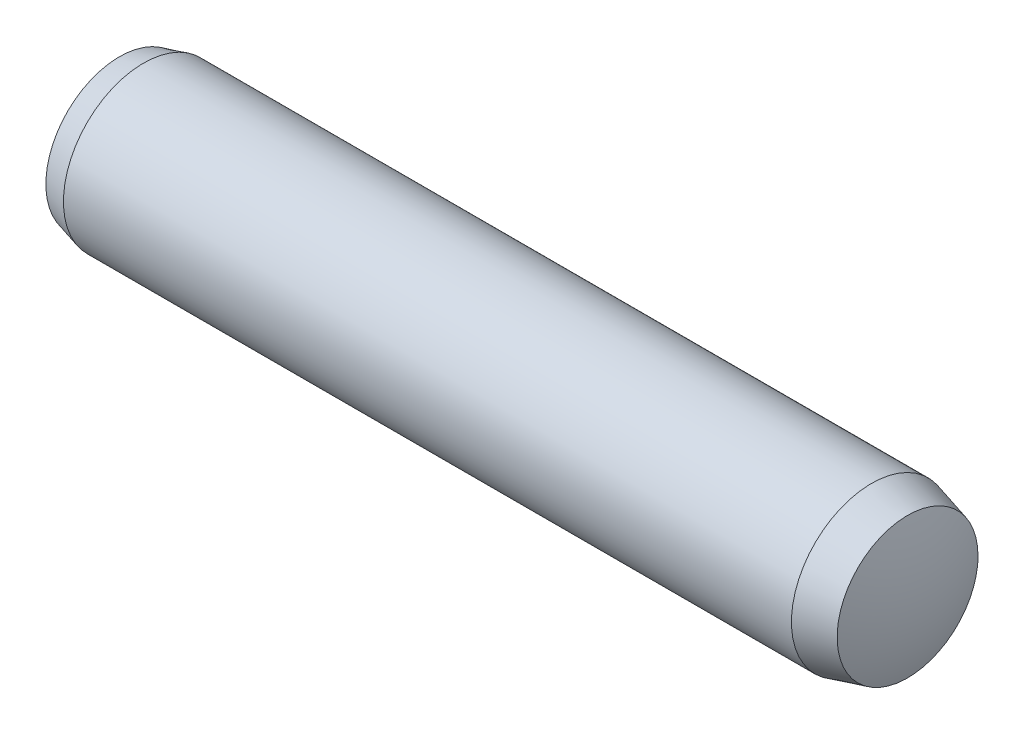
SolidWorks part; units mm, degrees
ref_plane "Plan de face" through (0, 0, 0) normal (0, 0, 1) x (1, 0, 0)
ref_plane "Plan de dessus" through (0, 0, 0) normal (0, 1, 0) x (1, 0, 0)
ref_plane "Plan de droite" through (0, 0, 0) normal (1, 0, 0) x (0, 0, -1)
sketch "Esquisse1" plane through (0, 0, 0) normal (0, 1, 0) x (1, 0, 0)
  line L0 (9.9605, 0) -> (8.8, 2.01)
  line L1 (8.8, 2.01) -> (0.8, 2.01)
  line L2 (0.8, 2.01) -> (0.8, 3.25)
  line L3 (0.8, 3.25) -> (0, 3.25)
  line L4 (0, 3.25) -> (0, 3.6785)
  line L5 (0, 3.6785) -> (1.2, 4)
  line L6 (1.2, 4) -> (37.56, 4)
  line L7 (37.56, 4) -> (39.361, 3.5174)
  line L8 (40, 0) -> (9.9605, 0)
  line L9 (40, 0) -> (9.9605, 0) construction
  arc A0 (39.361, 3.5174) -> (40, 0) centre (30, 0) cw
revolve "Révolution1" add sketch "Esquisse1" angle 360 about L9
ref_plane "Plan1" through (20, 0, 0) normal (1, 0, 0) x (0, 0, -1)
sketch "Esquisse2" plane through (0.8, 0, 0) normal (-1, 0, 0) x (0, 0, 1)
  line L0 (-3.9686, -0.5) -> (-3.9686, 0.5)
  line L1 (-3.9686, 0.5) -> (-4.9749, 0.5)
  line L2 (-4.9749, -0.5) -> (-3.9686, -0.5)
  arc A0 (-4.9749, 0.5) -> (-4.9749, -0.5) centre (0, 0) ccw
extrude "Enlèv. mat.-Extru.1" cut sketch "Esquisse2" against normal blind 40 and the other way blind 40
